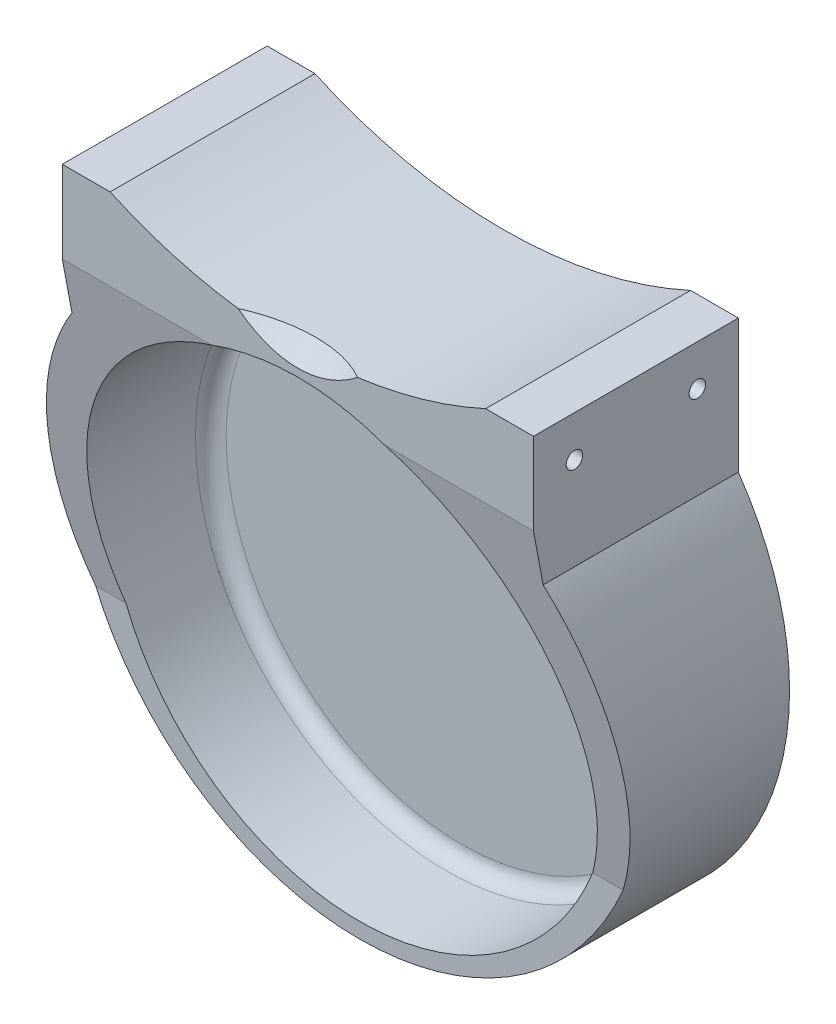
SolidWorks part; units mm, degrees
ref_plane "Front Plane" through (0, 0, 0) normal (0, 0, 1) x (1, 0, 0)
ref_plane "Top Plane" through (0, 0, 0) normal (0, 1, 0) x (1, 0, 0)
ref_plane "Right Plane" through (0, 0, 0) normal (1, 0, 0) x (0, 0, -1)
sketch "Sketch1" plane through (0, 0, 0) normal (0, 0, 1) x (1, 0, 0)
  line L2 (0, 0) -> (0, -82.55) construction
  line L8 (-73.025, 57.0507) -> (-73.025, 98.425)
  line L9 (73.025, 57.0507) -> (73.025, 98.425)
  line L11 (0, 0) -> (0, 98.425) construction
  line L18 (-73.025, 98.425) -> (73.025, 98.425)
  circle A0 centre (0, 0) radius 77.7875
  arc A5 (-73.025, 57.0507) -> (73.025, 57.0507) centre (0, 6.35) ccw
  point P18 (73.025, -69.85)
  point P21 (-73.025, -69.85)
  dimension "D1" = 155.575
  dimension "D2" = 88.9
  dimension "D3" = 180.975
  dimension "D4" = 98.425
  dimension "D5" = 146.05
extrude "Boss-Extrude1" add sketch "Sketch1" along normal blind 63.5
sketch "Sketch2" plane through (0, 0, 0) normal (0, 0, -1) x (-1, 0, 0)
  circle A2 centre (0, 0) radius 77.7875 construction
  circle A3 centre (0, 0) radius 38.1 construction
  circle A4 centre (0, 0) radius 77.7875
  dimension "D2" = 76.2
extrude "Boss-Extrude2" add sketch "Sketch2" against normal blind 12.7
fillet "Fillet7" radius 4.7625 1 edges at (-77.7875, 0, 12.7)
hole_wizard "1/4-20 Tapped Hole1" positions "Sketch20" profile "Sketch21" tap size "1/4-20" standard "ANSI Inch"
sketch "Sketch20" plane through (-73.025, 0, 0) normal (-1, 0, 0) x (0, 0, 1)
  line L0 (12.7, 85.725) -> (50.8, 85.725) construction
  line L2 (31.75, 85.725) -> (31.75, 98.425) construction
  line L3 (63.5, 98.425) -> (0, 98.425) construction
  point P0 (12.7, 85.725)
  point P2 (50.8, 85.725)
  dimension "D1" = 38.1
  dimension "D2" = 12.7
sketch "Sketch21" plane through (-73.025, 85.725, 12.7) normal (0, 1, 0) x (0, 0, 1)
  line L0 (0, 0) -> (0, 33.2838)
  line L1 (0, 33.2838) -> (2.5527, 31.75)
  line L2 (2.5527, 31.75) -> (2.5527, 0)
  line L5 (2.5527, 0) -> (0, 0)
  line L10 (0, 33.2838) -> (-2.5527, 31.75) construction
  line L11 (0, -6.35) -> (0, 107.95) construction
  dimension "Tap Drill Dia." = 5.1054
  dimension "Tap Drill Depth" = 31.75
  dimension "Drill Angle" = 118
mirror "Mirror1" about plane through (0, 0, 0) normal (1, 0, 0) of "1/4-20 Tapped Hole1"
sketch "Sketch22" plane through (0, 0, 0) normal (0, 0, -1) x (-1, 0, 0)
  line L0 (0, 98.425) -> (0, 225.425) construction
  line L1 (-73.025, 98.425) -> (73.025, 98.425) construction
  circle A0 centre (0, 225.425) radius 139.7
  point P6 (0, 85.725)
  dimension "D2" = 12.7
  dimension "D1" = 127
extrude "Cut-Extrude8" cut sketch "Sketch22" against normal through all
sketch "Sketch23" plane through (73.025, 0, 0) normal (1, 0, 0) x (0, 0, -1)
  line L0 (-63.5, 73.025) -> (-44.45, -28.575)
  line L1 (-63.5, 57.0507) -> (-63.5, 98.425) construction
  line L2 (-44.45, -28.575) -> (-44.45, -104.775)
  line L3 (-44.45, -104.775) -> (-63.5, -104.775)
  line L4 (-63.5, -104.775) -> (-63.5, 73.025)
  line L5 (-63.5, 98.425) -> (0, 98.425) construction
  dimension "D1" = 25.4
  dimension "D2" = 19.05
  dimension "D3" = 127
  dimension "D4" = 203.2
extrude "Cut-Extrude9" cut sketch "Sketch23" against normal through all and the other way through all
ref_plane "Plane1" through (0, 49.2125, -49.2125) normal (0, -0.7071, 0.7071) x (-1, 0, 0)
sketch "Sketch24" plane through (0, 49.2125, -49.2125) normal (0, -0.7071, 0.7071) x (-1, 0, 0)
  line L0 (0, 0) -> (0, -139.7) construction
  circle A0 centre (0, -139.7) radius 38.1
  dimension "D1" = 76.2
  dimension "D2" = 139.7
extrude "Cut-Extrude10" cut sketch "Sketch24" along normal through all
